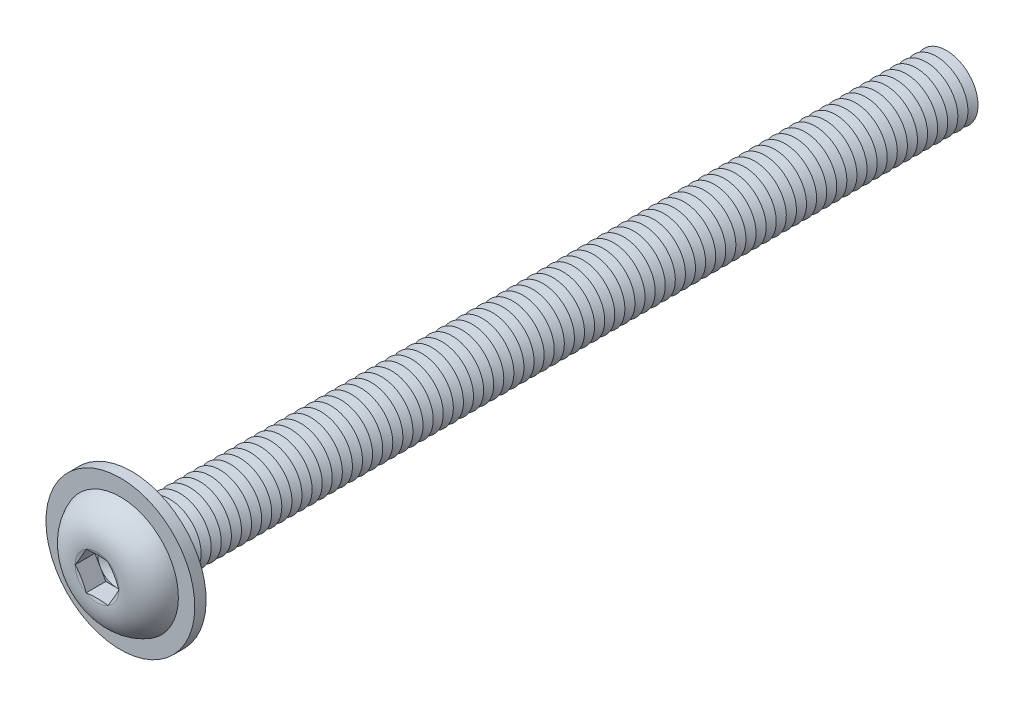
SolidWorks part; units mm, degrees
ref_plane "Front Plane" through (0, 0, 0) normal (0, 0, 1) x (1, 0, 0)
ref_plane "Top Plane" through (0, 0, 0) normal (0, 1, 0) x (1, 0, 0)
ref_plane "Right Plane" through (0, 0, 0) normal (1, 0, 0) x (0, 0, -1)
sketch "Sketch1" plane through (0, 0, 0) normal (1, 0, 0) x (0, 0, -1)
  line L0 (0, 2.5) -> (0, 4.75)
  line L3 (0, 2.5) -> (65, 2.5)
  line L4 (65, 2.5) -> (65, 0)
  line L5 (65, 0) -> (-2.75, 0) construction
  line L6 (-2.75, 0) -> (65, 0)
  line L7 (-2.75, 1.732) -> (-2.75, 0.866) construction
  line L8 (-2.75, 0.866) -> (-2.75, 0)
  line L9 (-2.75, 1.732) -> (-2.5179, 0.866)
  line L10 (-2.5179, 0.866) -> (-2.75, 0.866)
  line L11 (65, 0) -> (22.7481, 0) construction
  line L12 (0, 4.75) -> (-2.75, 4.75) construction
  arc A1 (0, 4.75) -> (-2.75, 1.732) centre (0, 1.9881) ccw
  point P8 (65, 1.25)
  dimension "D1" = 9.5
  dimension "D2" = 5
  dimension "D3" = 2.75
  dimension "D4" = 3.4641
  dimension "D5" = 65
  dimension "D6" = 15
revolve "Revolve1" add sketch "Sketch1" angle 360 about L5
fillet "Fillet1" radius 0.4 1 edges at (0, 2.5, 0)
sketch "Sketch2" plane through (0, 0, 0) normal (1, 0, 0) x (0, 0, -1)
  line L0 (64.6, 2.5) -> (65.4, 2.5)
  line L1 (65, 2.5) -> (0.4, 2.5) construction
  line L2 (65.4, 2.5) -> (65, 1.8072)
  line L3 (65, -2.5) -> (65, 2.5) construction
  line L4 (65, 1.8072) -> (64.6, 2.5)
  dimension "D1" = 0.8
revolve "Cut-Revolve1" cut sketch "Sketch2" angle 360 about axis through (0, 0, -65) along (0, 0, -1)
pattern_linear "LPattern1" count 81 spacing 0.8 along (0, 0, 1) of "Cut-Revolve1"
sketch "Sketch3" plane through (0, 0, 2.75) normal (0, 0, 1) x (1, 0, 0)
  line L7 (0.866, 1.5) -> (-0.866, 1.5)
  line L8 (-0.866, 1.5) -> (-1.7321, 0)
  line L9 (-1.7321, 0) -> (-0.866, -1.5)
  line L10 (-0.866, -1.5) -> (0.866, -1.5)
  line L11 (0.866, -1.5) -> (1.732, 0)
  line L12 (1.732, 0) -> (0.866, 1.5)
  circle A0 centre (0, 0) radius 1.5 construction
  circle A3 centre (0, 0) radius 1.7321 construction
extrude "Cut-Extrude1" cut sketch "Sketch3" against normal blind 1.56
sketch "Sketch4" plane through (0, 0, 1.19) normal (0, 0, 1) x (1, 0, 0)
  line L1 (0.866, 1.5) -> (-0.866, 1.5) construction
  circle A0 centre (0, 0) radius 1.5
extrude "Cut-Extrude2" cut sketch "Sketch4" against normal through all draft 60
sketch "Sketch5" plane through (0, 0, 0) normal (0, 0, -1) x (-1, 0, 0)
  circle A0 centre (0, 0) radius 5.9
  circle A1 centre (0, 0) radius 2.9
  circle A2 centre (0, 0) radius 2.9 construction
  dimension "D1" = 11.8
extrude "Boss-Extrude1" add sketch "Sketch5" against normal blind 0.9
